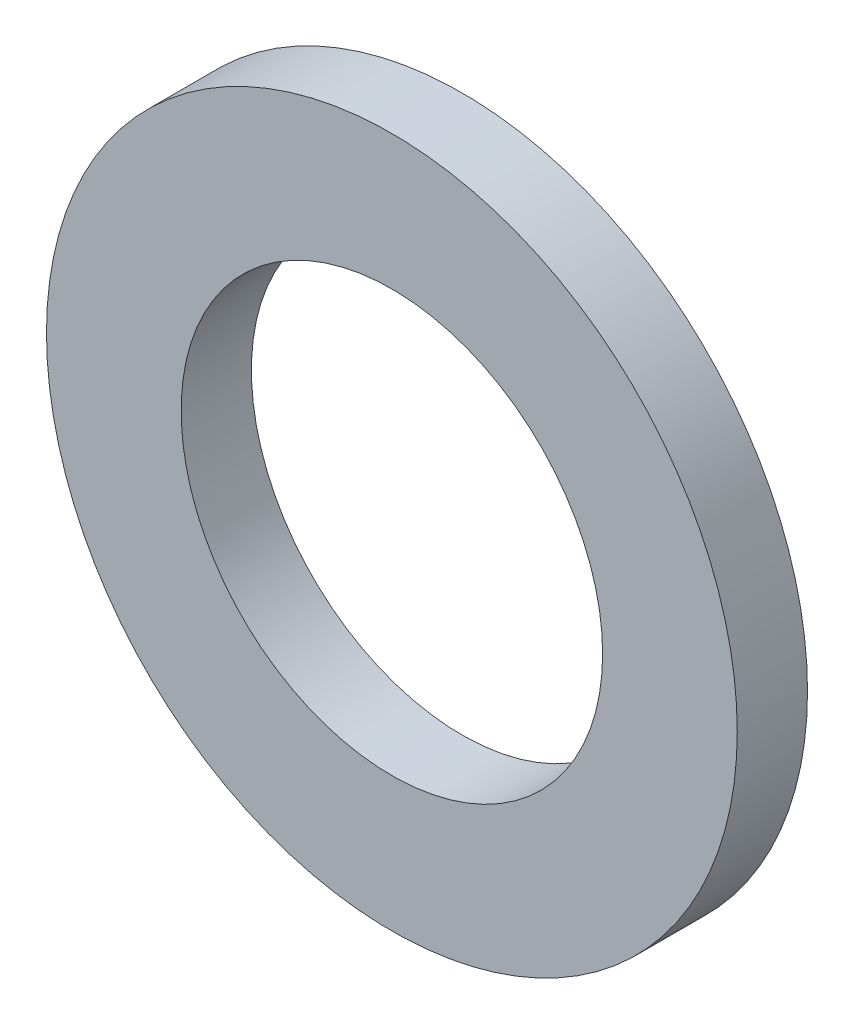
SolidWorks part; units mm, degrees
ref_plane "Plan de face" through (0, 0, 0) normal (0, 0, 1) x (1, 0, 0)
ref_plane "Plan de dessus" through (0, 0, 0) normal (0, 1, 0) x (1, 0, 0)
ref_plane "Plan de droite" through (0, 0, 0) normal (1, 0, 0) x (0, 0, -1)
sketch "Esquisse1" plane through (0, 0, 0) normal (0, 0, 1) x (1, 0, 0)
  circle A0 centre (0, 0) radius 14.75
  circle A1 centre (0, 0) radius 9
  dimension "D1" = 29.5
  dimension "D2" = 18
extrude "Extrusion1" add sketch "Esquisse1" along normal blind 3
